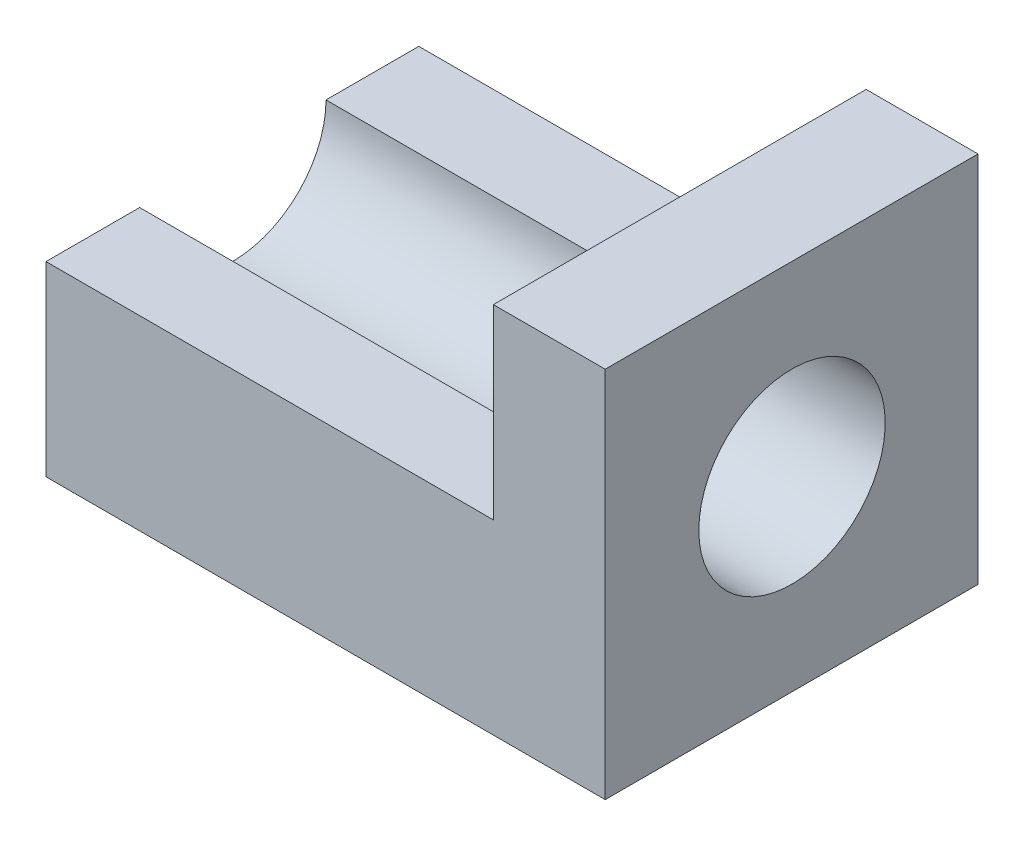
SolidWorks part; units mm, degrees
ref_plane "前视基准面" through (0, 0, 0) normal (0, 0, 1) x (1, 0, 0)
ref_plane "上视基准面" through (0, 0, 0) normal (0, 1, 0) x (1, 0, 0)
ref_plane "右视基准面" through (0, 0, 0) normal (1, 0, 0) x (0, 0, -1)
sketch "草图1" plane through (0, 0, 0) normal (1, 0, 0) x (0, 0, -1)
  line L0 (0, 0) -> (0, 67.8428) construction
  line L1 (-50, 0) -> (50, 0)
  line L2 (50, 0) -> (50, 50)
  line L3 (50, 50) -> (25.1109, 50)
  line L4 (-50, 0) -> (-50, 50)
  line L5 (-50, 50) -> (-24.8891, 50)
  arc A0 (25.1109, 50) -> (-24.8891, 50) centre (0.1109, 50) cw
  dimension "D1" = 25
  dimension "D2" = 50
  dimension "D3" = 100
extrude "拉伸1" add sketch "草图1" along normal blind 150
sketch "草图2" plane through (150, 0, 0) normal (1, 0, 0) x (0, 0, -1)
  line L0 (50, 50) -> (50, 100)
  line L1 (-50, 50) -> (-50, 100)
  line L2 (-50, 100) -> (50, 100)
  line L3 (-50, 50) -> (-24.8891, 50)
  line L4 (25.1109, 50) -> (50, 50)
  arc A0 (25.1109, 50) -> (-24.8891, 50) centre (0.1109, 50) ccw
extrude "拉伸2" add sketch "草图2" against normal blind 30
